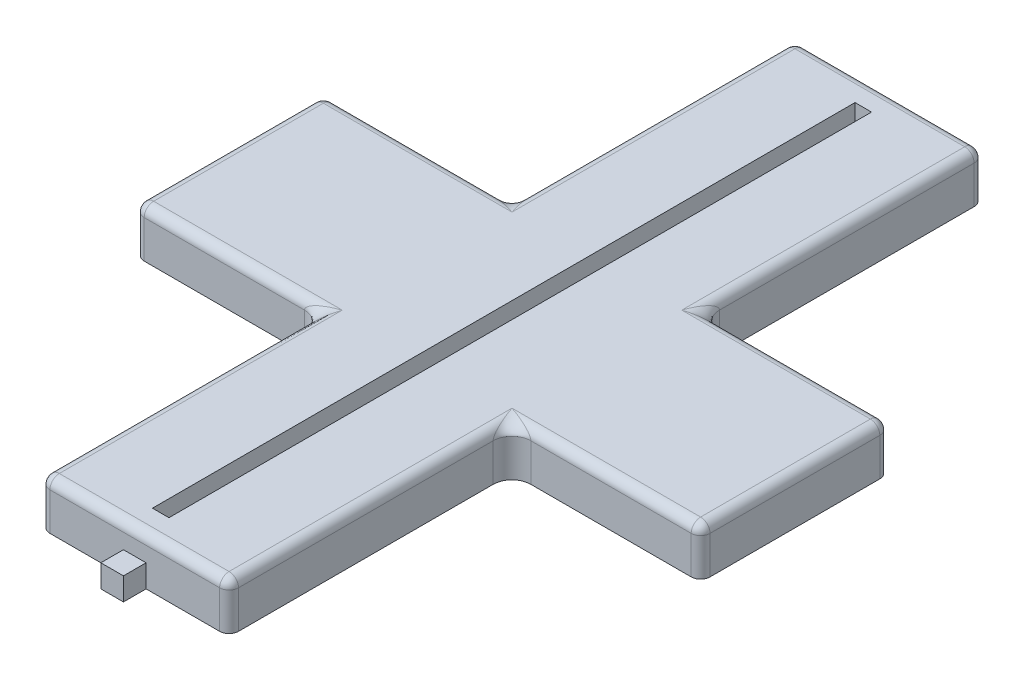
SolidWorks part; units mm, degrees
ref_plane "Front Plane" through (0, 0, 0) normal (0, 0, 1) x (1, 0, 0)
ref_plane "Top Plane" through (0, 0, 0) normal (0, 1, 0) x (1, 0, 0)
ref_plane "Right Plane" through (0, 0, 0) normal (1, 0, 0) x (0, 0, -1)
sketch "Sketch1" plane through (0, 0, 0) normal (0, 1, 0) x (1, 0, 0)
  line L1 (25.4, 101.6) -> (-25.4, 101.6)
  line L2 (25.4, 101.6) -> (25.4, -101.6)
  line L3 (25.4, -101.6) -> (-25.4, -101.6)
  line L4 (-25.4, 101.6) -> (-25.4, -101.6)
  line L5 (25.4, 101.6) -> (-25.4, -101.6) construction
  line L6 (25.4, -101.6) -> (-25.4, 101.6) construction
  point P0 (0, 0)
  dimension "D1" = 50.8
  dimension "D2" = 203.2
extrude "Boss-Extrude1" add sketch "Sketch1" along normal blind 12.7
sketch "Sketch2" plane through (0, 12.7, 0) normal (0, 1, 0) x (1, 0, 0)
  line L1 (2.2225, 94.6109) -> (-2.2225, 94.6109)
  line L2 (2.2225, 94.6109) -> (2.2225, -94.6109)
  line L3 (2.2225, -94.6109) -> (-2.2225, -94.6109)
  line L4 (-2.2225, 94.6109) -> (-2.2225, -94.6109)
  line L5 (2.2225, 94.6109) -> (-2.2225, -94.6109) construction
  line L6 (2.2225, -94.6109) -> (-2.2225, 94.6109) construction
  point P0 (0, 0)
  dimension "D1" = 4.445
extrude "Cut-Extrude1" cut sketch "Sketch2" against normal blind 6.35
sketch "Sketch3" plane through (0, 0, 101.6) normal (0, 0, 1) x (1, 0, 0)
  line L0 (-25.4, 0) -> (25.4, 0) construction
  line L1 (-3.048, 6.096) -> (3.048, 6.096)
  line L2 (-3.048, 6.096) -> (-3.048, 0)
  line L3 (-3.048, 0) -> (3.048, 0)
  line L4 (3.048, 6.096) -> (3.048, 0)
  line L5 (-3.048, 6.096) -> (3.048, 0) construction
  line L6 (-3.048, 0) -> (3.048, 6.096) construction
  point P0 (0, 3.048)
  point P5 (0, 0)
  dimension "D1" = 6.096
extrude "Boss-Extrude2" add sketch "Sketch3" along normal blind 6.096
sketch "Sketch4" plane through (25.4, 0, 0) normal (1, 0, 0) x (0, 0, -1)
  line L0 (-101.6, 12.7) -> (101.6, 12.7) construction
  line L1 (-25.4, 12.7) -> (25.4, 12.7)
  line L2 (-25.4, 12.7) -> (-25.4, 0)
  line L3 (-25.4, 0) -> (25.4, 0)
  line L4 (25.4, 12.7) -> (25.4, 0)
  line L5 (-25.4, 12.7) -> (25.4, 0) construction
  line L6 (-25.4, 0) -> (25.4, 12.7) construction
  line L7 (-101.6, 0) -> (101.6, 0) construction
  point P0 (0, 6.35)
  point P9 (6.4585, 6.35)
  point P10 (0, 0)
  point P11 (43.2496, 6.35)
  point P12 (0, 0)
  dimension "D1" = 50.8
extrude "Boss-Extrude3" add sketch "Sketch4" along normal blind 50.8
mirror "Mirror1" about plane through (0, 0, 0) normal (1, 0, 0) of "Boss-Extrude3"
fillet "Fillet1" radius 2.54 20 edges at (-76.2, 12.7, 0) (76.2, 12.7, 0) (25.4, 12.7, 63.5) (50.8, 12.7, 25.4) (50.8, 12.7, -25.4) (25.4, 12.7, -63.5) (0, 12.7, -101.6) (-25.4, 12.7, -63.5) (-50.8, 12.7, -25.4) (-50.8, 12.7, 25.4) (-25.4, 12.7, 63.5) (0, 12.7, 101.6) (25.4, 6.35, -101.6) (-25.4, 6.35, -101.6) (-76.2, 6.35, -25.4) (-76.2, 6.35, 25.4) (-25.4, 6.35, 101.6) (25.4, 6.35, 101.6) (76.2, 6.35, 25.4) (76.2, 6.35, -25.4)
fillet "Fillet2" radius 5.08 8 edges at (-24.6561, 11.9561, 24.6561) (24.6561, 11.9561, 24.6561) (24.6561, 11.9561, -24.6561) (-24.6561, 11.9561, -24.6561) (-25.4, 5.08, 25.4) (25.4, 5.08, 25.4) (25.4, 5.08, -25.4) (-25.4, 5.08, -25.4)
